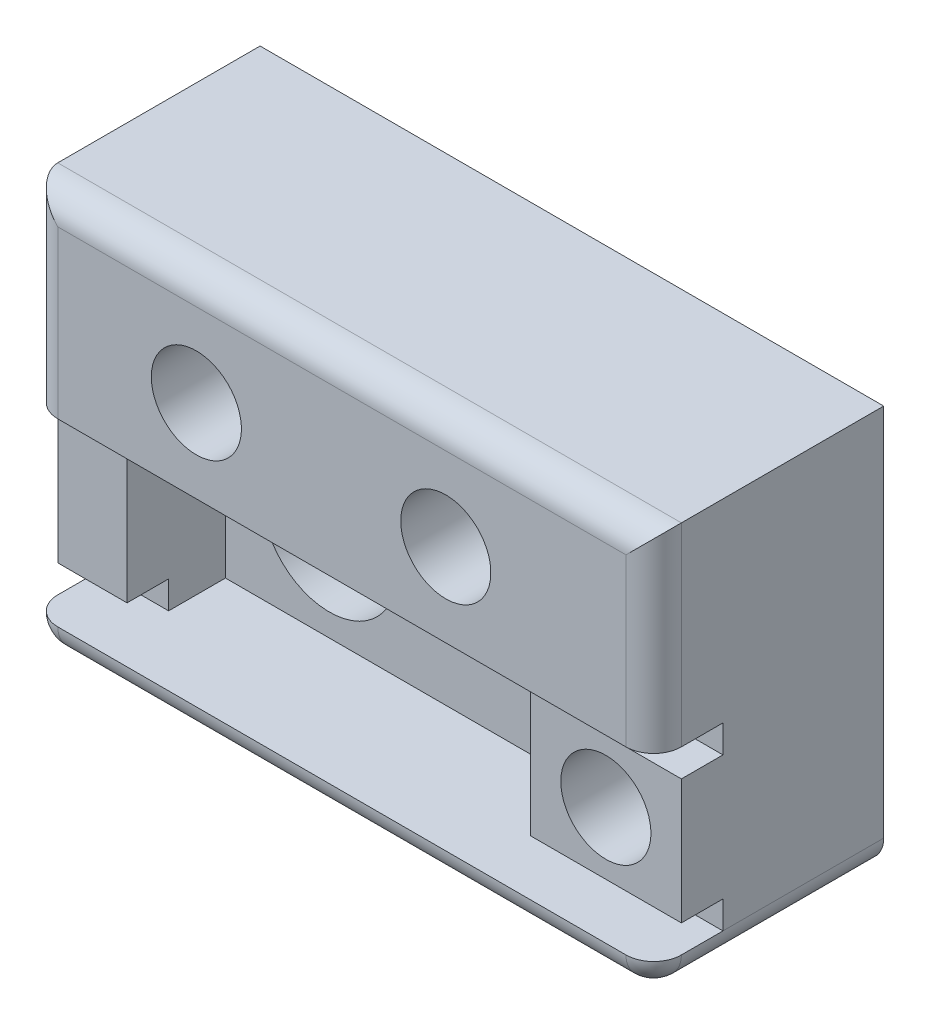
SolidWorks part; units mm, degrees
ref_plane "Front Plane" through (0, 0, 0) normal (0, 0, 1) x (1, 0, 0)
ref_plane "Top Plane" through (0, 0, 0) normal (0, 1, 0) x (1, 0, 0)
ref_plane "Right Plane" through (0, 0, 0) normal (1, 0, 0) x (0, 0, -1)
sketch "Sketch1" plane through (0, 0, 0) normal (0, 0, 1) x (1, 0, 0)
  line L0 (45, 12) -> (12.5, 12) construction
  line L3 (0, 32.5) -> (45, 32.5)
  line L5 (45, -17.5) -> (0, -17.5)
  line L6 (45, 32.5) -> (45, -17.5)
  line L14 (12.5, 12) -> (12.5, -3) construction
  line L15 (12.5, -3) -> (32.5, -3) construction
  line L16 (0, 32.5) -> (0, -17.5)
  circle A0 centre (12.5, 12) radius 4.875
  circle A1 centre (32.5, -3) radius 4.875
  dimension "D4" = 9.75
  dimension "D7" = 15
  dimension "D5" = 20.5
  dimension "D1" = 12
  dimension "D2" = 12.5
  dimension "D3" = 50
  dimension "D6" = 12.5
  dimension "D8" = 12.5
  dimension "D9" = 20
extrude "Boss-Extrude1" add sketch "Sketch1" along normal blind 7.5
sketch "Sketch4" plane through (0, 0, 0) normal (0, 0, -1) x (-1, 0, 0)
  line L0 (-5, 5.5) -> (-34.1, 5.5)
  line L1 (-34.1, 18.5) -> (-5, 18.5)
  line L3 (-34.1, 5.5) -> (-34.1, 18.5)
  line L4 (-45, 32.5) -> (-45, -17.5)
  line L5 (-45, -17.5) -> (0, -17.5)
  line L7 (0, 32.5) -> (-45, 32.5)
  line L11 (0, 32.5) -> (-45, 32.5)
  line L14 (-5, 18.5) -> (-5, 5.5)
  line L16 (-45, -17.5) -> (-45, 32.5) construction
  line L17 (0, 32.5) -> (0, -17.5) construction
  line L18 (-45, 3.5) -> (0, 3.5)
  line L22 (-45, 32.5) -> (-45, 3.5)
  line L23 (0, -17.5) -> (0, 32.5)
  line L24 (0, 3.5) -> (0, 32.5)
  dimension "D2" = 27
  dimension "D3" = 14
  dimension "D4" = 29.1
  dimension "D5" = 5
  dimension "D6" = 2
  dimension "D1" = 0
extrude "Boss-Extrude4" add sketch "Sketch4" along normal blind 7.1
sketch "Sketch18" plane through (0, 0, -7.1) normal (0, 0, -1) x (-1, 0, 0)
  line L7 (-45, 32.5) -> (-45, 3.5) construction
  line L9 (-45, 32.5) -> (0, 32.5)
  line L10 (-45, 32.5) -> (-45, 18.5)
  line L11 (-45, 18.5) -> (0, 18.5)
  line L19 (0, 3.5) -> (0, 32.5) construction
  line L21 (-45, 3.5) -> (0, 3.5) construction
  line L22 (-45, 5.5) -> (0, 5.5)
  line L23 (0, 32.5) -> (0, 18.5)
  line L24 (-45, 5.5) -> (-45, 3.5)
  line L25 (-45, 3.5) -> (0, 3.5)
  line L26 (0, 5.5) -> (0, 3.5)
  dimension "D3" = 27
  dimension "D1" = 14
extrude "Boss-Extrude7" add sketch "Sketch18" along normal blind 2
sketch "Sketch19" plane through (0, 0, 7.5) normal (0, 0, 1) x (1, 0, 0)
  line L0 (12.5, 12) -> (12.5, 32.5) construction
  line L1 (0, -17.5) -> (20, -17.5)
  line L2 (0, -17.5) -> (0, -0.5)
  line L3 (0, -0.5) -> (20, -0.5)
  line L4 (20, -17.5) -> (20, -0.5)
  line L5 (45, 32.5) -> (0, 32.5) construction
  line L6 (32.5, -3) -> (32.5, -17.5) construction
  line L7 (0, -17.5) -> (45, -17.5) construction
  line L8 (12.5, 12) -> (0, 12) construction
  line L9 (0, 32.5) -> (0, -17.5) construction
  dimension "D1" = 12.5
  dimension "D2" = 12.5
extrude "Cut-Extrude1" cut sketch "Sketch19" against normal up to next
sketch "Sketch21" plane through (0, -17.5, 0) normal (0, -1, 0) x (1, 0, 0)
  line L1 (45, 7.5) -> (0, 7.5)
  line L2 (45, 7.5) -> (45, -9.1)
  line L3 (45, -9.1) -> (0, -9.1)
  line L4 (0, 7.5) -> (0, -9.1)
extrude "Cut-Extrude3" cut sketch "Sketch21" against normal blind 21
sketch "Sketch25" plane through (0, 0, -7.1) normal (0, 0, -1) x (-1, 0, 0)
  line L0 (-34.1, 12) -> (-45, 12) construction
  line L1 (-34.1, 18.5) -> (-34.1, 5.5) construction
  line L2 (-45, 18.5) -> (-45, 5.5) construction
  circle A0 centre (-39.55, 12) radius 1.65
  dimension "D1" = 3.3
extrude "Cut-Extrude7" cut sketch "Sketch25" against normal through all
sketch "Sketch26" plane through (0, 0, -7.1) normal (0, 0, -1) x (-1, 0, 0)
  circle A0 centre (-39.55, 12) radius 3.25
  dimension "D1" = 6.5
extrude "Cut-Extrude8" cut sketch "Sketch26" against normal blind 12.6
fillet "Fillet1" radius 2 6 edges at (45, 25.5, -9.1) (0, 25.5, -9.1) (45, 3.5, -0.8) (22.5, 32.5, -9.1) (0, 3.5, -0.8) (22.5, 3.5, -9.1)
sketch "Sketch27" plane through (0, 0, -9.1) normal (0, 0, -1) x (-1, 0, 0)
  line L0 (-2, 24.5) -> (-43, 24.5) construction
  line L1 (-2, 18.5) -> (-2, 30.5) construction
  line L2 (-43, 30.5) -> (-43, 18.5) construction
  line L3 (0, 32.5) -> (0, 18.5) construction
  line L4 (-45, 18.5) -> (-45, 32.5) construction
  circle A0 centre (-12, 24.5) radius 1.65
  circle A1 centre (-30, 24.5) radius 1.65
  dimension "D1" = 3.3
  dimension "D2" = 12
  dimension "D3" = 15
extrude "Cut-Extrude9" cut sketch "Sketch27" against normal through all
sketch "Sketch29" plane through (0, 0, -7.1) normal (0, 0, -1) x (-1, 0, 0)
  line L0 (0, 12) -> (-45, 12) construction
  line L1 (0, 5.5) -> (-60, 5.5)
  line L2 (0, 5.5) -> (0, 7.5)
  line L3 (0, 7.5) -> (-60, 7.5)
  line L4 (-60, 5.5) -> (-60, 7.5)
  line L5 (0, 5.5) -> (0, 18.5) construction
  line L6 (-45, 18.5) -> (-45, 5.5) construction
  line L7 (0, 16.5) -> (-60, 16.5)
  line L8 (-60, 18.5) -> (-60, 16.5)
  line L9 (0, 18.5) -> (-60, 18.5)
  line L10 (0, 18.5) -> (0, 16.5)
  dimension "D1" = 2
  dimension "D2" = 60
extrude "Cut-Extrude11" cut sketch "Sketch29" against normal blind 3
sketch "Sketch30" plane through (0, 0, -9.1) normal (0, 0, -1) x (-1, 0, 0)
  circle A0 centre (-30, 24.5) radius 3.25
  circle A1 centre (-12, 24.5) radius 3.25
  dimension "D1" = 6.5
extrude "Cut-Extrude12" cut sketch "Sketch30" against normal blind 14.6
mirror "Mirror1" about plane through (0, 0, 7.5) normal (0, 0, -1)
sketch "Sketch28" plane through (0, 3.5, 0) normal (0, -1, 0) x (1, 0, 0)
  line L1 (0, 7.5) -> (60, 7.5)
  line L2 (0, 7.5) -> (0, -23.6809)
  line L3 (0, -23.6809) -> (60, -23.6809)
  line L4 (60, 7.5) -> (60, -23.6809)
  line L5 (0, -4.1) -> (0, 19.1) construction
  point P8 (0, 7.5)
  dimension "D1" = 60
extrude "Cut-Extrude10" cut sketch "Sketch28" against normal through all
